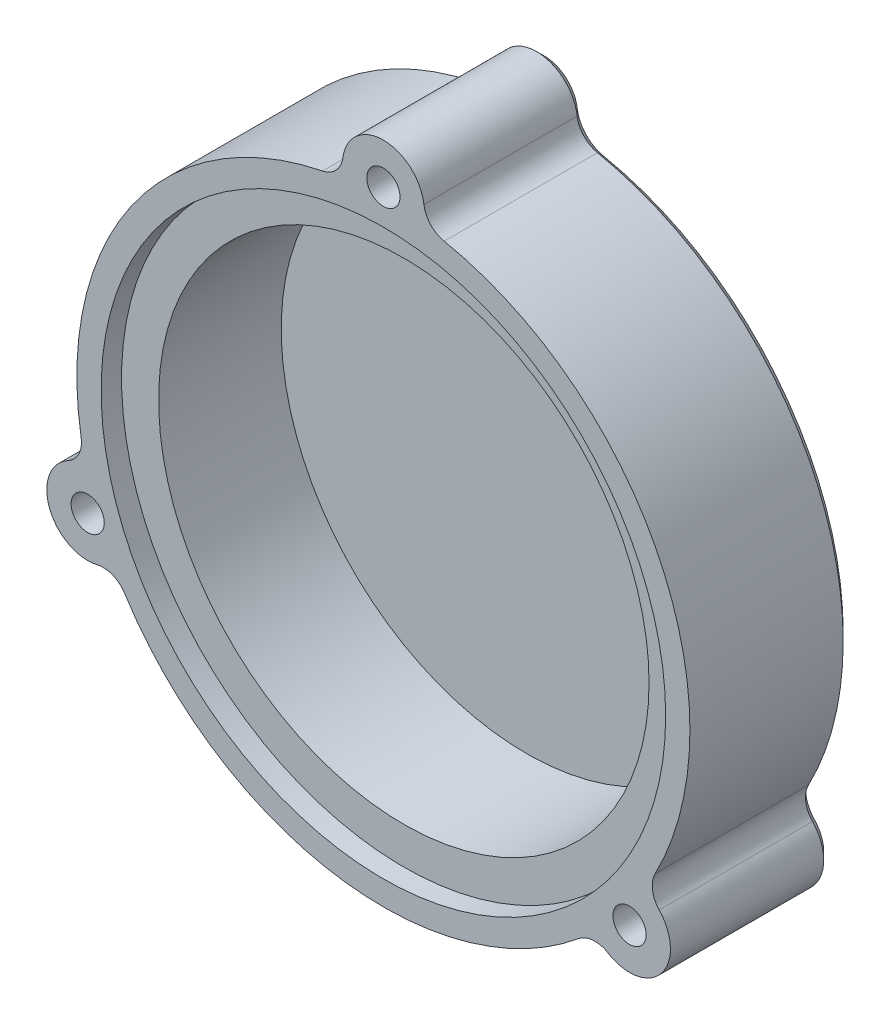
SolidWorks part; units mm, degrees
ref_plane "Front Plane" through (0, 0, 0) normal (0, 0, 1) x (1, 0, 0)
ref_plane "Top Plane" through (0, 0, 0) normal (0, 1, 0) x (1, 0, 0)
ref_plane "Right Plane" through (0, 0, 0) normal (1, 0, 0) x (0, 0, -1)
sketch "Sketch1" plane through (0, 0, 0) normal (0, 0, 1) x (1, 0, 0)
  arc A0 (-7.6046, 59.5161) -> (-58.2883, -14.2291) centre (0, 0) ccw
  arc A1 (7.6046, 59.5161) -> (-7.6046, 59.5161) centre (0, 62) ccw
  arc A2 (41.467, -43.3646) -> (51.0385, -31.5448) centre (48.183, -39.0179) ccw
  arc A3 (-58.2883, -14.2291) -> (-52.8378, -28.4282) centre (-57.882, -22.2188) ccw
  arc A4 (-52.8378, -28.4282) -> (41.467, -43.3646) centre (0, 0) ccw
  arc A5 (51.0385, -31.5448) -> (7.6046, 59.5161) centre (0, 0) ccw
  dimension "D1" = 120
  dimension "D2" = 16
  dimension "D4" = 16
  dimension "D7" = 16
  dimension "D3" = 62
  dimension "D5" = 62
  dimension "D6" = 129
  dimension "D8" = 62
  dimension "D9" = 111
extrude "Boss-Extrude1" add sketch "Sketch1" along normal blind 31.5
sketch "Sketch2" plane through (0, 0, 31.5) normal (0, 0, 1) x (1, 0, 0)
  circle A0 centre (0, 0) radius 55.25
  dimension "D1" = 110.5
extrude "Cut-Extrude1" cut sketch "Sketch2" against normal blind 4
sketch "Sketch3" plane through (0, 0, 31.5) normal (0, 0, 1) x (1, 0, 0)
  circle A0 centre (0, 0) radius 48
  dimension "D1" = 96
extrude "Cut-Extrude2" cut sketch "Sketch3" against normal blind 28
sketch "Sketch4" plane through (0, 0, 31.5) normal (0, 0, 1) x (1, 0, 0)
  circle A0 centre (0, 62) radius 3.25
  circle A1 centre (48.183, -39.0179) radius 3.25
  circle A2 centre (-57.882, -22.2188) radius 3.25
  dimension "D1" = 6.5
extrude "Cut-Extrude3" cut sketch "Sketch4" against normal through all
sketch "Sketch5" plane through (0, 0, 0) normal (0, 0, -1) x (-1, 0, 0)
  circle A2 centre (0, 62) radius 4.75
  circle A3 centre (0, 62) radius 4.75
  circle A13 centre (-48.183, -39.0179) radius 4.75
  circle A14 centre (-48.183, -39.0179) radius 4.75
  circle A16 centre (57.882, -22.2188) radius 4.75
  circle A17 centre (57.882, -22.2188) radius 4.75
  dimension "D2" = 1.5
  dimension "D1" = 1.5
  dimension "D3" = 1.5
extrude "Cut-Extrude4" cut sketch "Sketch5" against normal blind 15
fillet "Fillet1" radius 5 6 edges at (51.0385, -31.5448, 15.75) (41.467, -43.3646, 15.75) (-58.2883, -14.2291, 15.75) (-52.8378, -28.4282, 15.75) (-7.6046, 59.5161, 15.75) (7.6046, 59.5161, 15.75)
chamfer "Chamfer4" distance 1.5 angle 45 12 edges at (54.4002, -44.0524, 0) (52.6697, -30.7693, 0) (41.0475, -45.1215, 0) (54.1551, 25.8307, 0) (-9.3861, -59.2613, 0) (9.2339, 60.2958, 0) (-52.9818, -30.2287, 0) (0, 70, 0) (-65.3506, -25.0858, 0) (-9.2339, 60.2958, 0) (-59.6001, -12.9875, 0) (-49.4476, 33.9844, 0)
